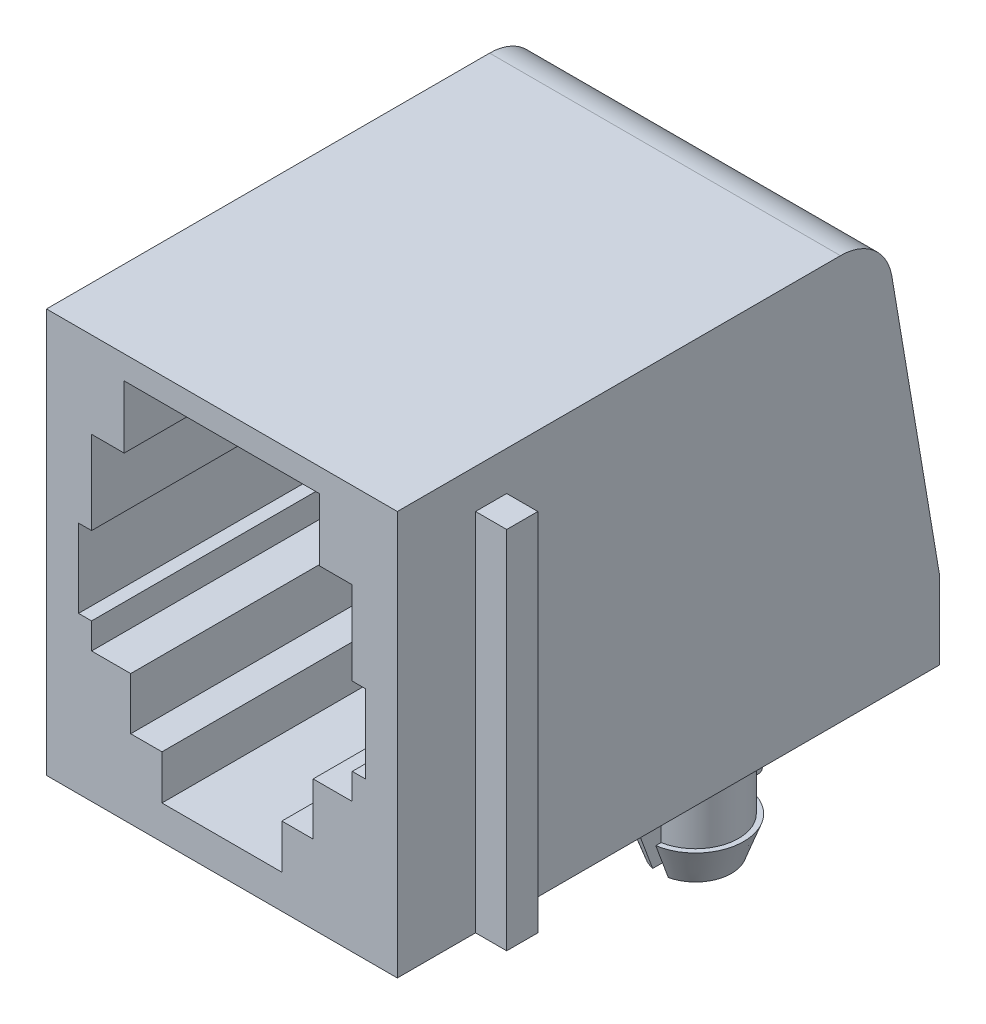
SolidWorks part; units mm, degrees
ref_plane "Front" through (0, 0, 0) normal (0, 0, 1) x (1, 0, 0)
ref_plane "Top" through (0, 0, 0) normal (0, 1, 0) x (1, 0, 0)
ref_plane "Right" through (0, 0, 0) normal (1, 0, 0) x (0, 0, -1)
sketch "Эскиз1" plane through (0, 0, 0) normal (0, 1, 0) x (1, 0, 0)
  circle A0 centre (0, 0) radius 0.4
  dimension "D1" = 0.8
extrude "Вытянуть1" add sketch "Эскиз1" against normal blind 3.3
sketch "Эскиз2" plane through (0, 0, 0) normal (0, 1, 0) x (1, 0, 0)
  line L1 (9.905, -19.53) -> (-3.555, -19.53)
  line L2 (9.905, -19.53) -> (9.905, 1.27)
  line L3 (9.905, 1.27) -> (-3.555, 1.27)
  line L4 (-3.555, -19.53) -> (-3.555, 1.27)
  dimension "D1" = 20.8
  dimension "D2" = 13.46
  dimension "D3" = 3.555
  dimension "D4" = 1.27
extrude "Вытянуть2" add sketch "Эскиз2" along normal blind 15.5
sketch "Эскиз3" plane through (0, 0, 19.53) normal (0, 0, -1) x (-1, 0, 0)
  line L0 (-0.875, 1.3) -> (-5.475, 1.3)
  line L1 (-5.475, 1.3) -> (-5.475, 3)
  line L2 (-5.475, 3) -> (-6.675, 3)
  line L3 (-6.675, 3) -> (-6.675, 5)
  line L4 (-6.675, 5) -> (-8.175, 5)
  line L5 (-8.175, 5) -> (-8.175, 6)
  line L6 (-8.175, 6) -> (-8.675, 6)
  line L7 (-8.675, 6) -> (-8.675, 9)
  line L8 (-8.675, 9) -> (-8.175, 9)
  line L9 (-8.175, 9) -> (-8.175, 12.2)
  line L10 (-8.175, 12.2) -> (-6.925, 12.2)
  line L11 (-3.175, 14.6) -> (-3.175, 1.3) construction
  line L12 (1.825, 9) -> (1.825, 12.2)
  line L13 (2.325, 9) -> (1.825, 9)
  line L14 (2.325, 6) -> (2.325, 9)
  line L15 (1.825, 6) -> (2.325, 6)
  line L16 (1.825, 5) -> (1.825, 6)
  line L17 (0.325, 5) -> (1.825, 5)
  line L18 (0.325, 3) -> (0.325, 5)
  line L19 (-0.875, 3) -> (0.325, 3)
  line L20 (-0.875, 1.3) -> (-0.875, 3)
  line L21 (-9.905, 0) -> (3.555, 0) construction
  line L22 (0.575, 12.2) -> (0.575, 14.6)
  line L23 (0.575, 14.6) -> (-6.925, 14.6)
  line L24 (-6.925, 12.2) -> (-6.925, 14.6)
  line L25 (0.575, 12.2) -> (1.825, 12.2)
  line L26 (3.555, 15.5) -> (-9.905, 15.5) construction
  dimension "D2" = 10
  dimension "D3" = 11
  dimension "D4" = 7
  dimension "D5" = 4.6
  dimension "D6" = 1.3
  dimension "D7" = 3
  dimension "D8" = 5
  dimension "D9" = 6
  dimension "D10" = 3
  dimension "D11" = 12.2
  dimension "D12" = 3.175
  dimension "D13" = 7.5
  dimension "D14" = 0.9
extrude "Вырез-Вытянуть1" cut sketch "Эскиз3" along normal blind 11.3
sketch "Эскиз7" plane through (9.905, 0, 0) normal (1, 0, 0) x (0, 0, -1)
  line L0 (1.27, 3) -> (-0.5579, 13.8328)
  line L1 (1.27, 15.5) -> (1.27, 0) construction
  line L2 (-19.53, 15.5) -> (1.27, 15.5) construction
  line L3 (-2.53, 15.5) -> (1.27, 15.5)
  line L4 (1.27, 15.5) -> (1.27, 3)
  line L5 (-19.53, 15.5) -> (-19.53, 0) construction
  line L6 (-19.53, 0) -> (1.27, 0) construction
  arc A0 (-0.5579, 13.8328) -> (-2.53, 15.5) centre (-2.53, 13.5) ccw
  dimension "D2" = 2
  dimension "D1" = 17
  dimension "D3" = 3
extrude "Вырез-Вытянуть3" cut sketch "Эскиз7" against normal through all
sketch "Эскиз8" plane through (0, 0, -1.27) normal (0, 0, -1) x (-1, 0, 0)
  line L0 (-3.175, 0) -> (-3.175, 13) construction
  line L1 (-8.175, 3) -> (1.825, 3)
  line L2 (-8.175, 3) -> (-8.175, 13)
  line L3 (-8.175, 13) -> (1.825, 13)
  line L4 (1.825, 3) -> (1.825, 13)
  line L5 (-9.905, 0) -> (3.555, 0) construction
  line L6 (3.555, 3) -> (-9.905, 3) construction
  dimension "D1" = 10
extrude "Вырез-Вытянуть4" cut sketch "Эскиз8" against normal blind 5
sketch "Эскиз4" plane through (0, 0, 0) normal (1, 0, 0) x (0, 0, -1)
  line L0 (0, 2) -> (0, 5) construction
  line L1 (-0.0697, 5.8319) -> (-1.3959, 13.6914) construction
  line L2 (-2.53, 14.6502) -> (-16.53, 14.6502) construction
  line L3 (-16.6745, 13.4678) -> (-6.73, 11) construction
  line L4 (0.3, 2) -> (0.3, 5)
  line L5 (0.2261, 5.8818) -> (-1.1, 13.7413)
  line L6 (-2.53, 14.9502) -> (-16.53, 14.9502)
  line L7 (-16.7468, 13.1767) -> (-6.8023, 10.7088)
  line L8 (-0.3, 2) -> (-0.3, 5)
  line L12 (-0.3655, 5.782) -> (-1.6917, 13.6415)
  line L13 (-2.53, 14.3502) -> (-16.53, 14.3502)
  line L14 (-16.6023, 13.759) -> (-6.6577, 11.2912)
  line L15 (1.27, 3) -> (-0.4174, 13) construction
  line L16 (-19.53, 0) -> (1.27, 0) construction
  line L17 (1.27, 3) -> (1.27, 0) construction
  line L18 (-19.53, 15.5) -> (-19.53, 0) construction
  arc A0 (-1.3959, 13.6914) -> (-2.53, 14.6502) centre (-2.53, 13.5) ccw construction
  arc A1 (-16.53, 14.6502) -> (-16.6745, 13.4678) centre (-16.53, 14.0502) ccw construction
  arc A2 (-0.5579, 13.8328) -> (-2.53, 15.5) centre (-2.53, 13.5) ccw construction
  arc A3 (0, 5) -> (-0.0697, 5.8319) centre (-5, 5) ccw construction
  arc A4 (0.3, 5) -> (0.2261, 5.8818) centre (-5, 5) ccw
  arc A5 (-1.1, 13.7413) -> (-2.53, 14.9502) centre (-2.53, 13.5) ccw
  arc A6 (-16.53, 14.9502) -> (-16.7468, 13.1767) centre (-16.53, 14.0502) ccw
  arc A7 (-0.3, 5) -> (-0.3655, 5.782) centre (-5, 5) ccw
  arc A8 (-1.6917, 13.6415) -> (-2.53, 14.3502) centre (-2.53, 13.5) ccw
  arc A9 (-16.53, 14.3502) -> (-16.6023, 13.759) centre (-16.53, 14.0502) ccw
  arc A10 (0.3, 2) -> (-0.3, 2) centre (0, 2) cw
  arc A11 (-6.8023, 10.7088) -> (-6.6577, 11.2912) centre (-6.73, 11) ccw
  dimension "D3" = 0.3
  dimension "D1" = 5
  dimension "D2" = 0.6
  dimension "D4" = 0.3
  dimension "D5" = 2
  dimension "D6" = 5
  dimension "D7" = 11
  dimension "D8" = 8
  dimension "D9" = 3
extrude "Вытянуть3" add sketch "Эскиз4" along normal mid plane 0.6
pattern_linear "Линейный массив1" count 6 spacing 1.27 along (1, 0, 0) count 2 spacing 2.54 along (0, 0, 1) of "Вытянуть1"
pattern_linear "Линейный массив3" count 6 spacing 1.27 along (1, 0, 0) of "Вытянуть3"
ref_plane "Плоскость1" through (-1.815, 0, 0) normal (1, 0, 0) x (0, 0, -1)
sketch "Эскиз5" plane through (-1.815, 0, 0) normal (1, 0, 0) x (0, 0, -1)
  line L0 (-6.35, 0) -> (-6.35, -3.3) construction
  line L1 (1.27, 0) -> (-19.53, 0) construction
  line L2 (-0.4, -3.3) -> (0.4, -3.3) construction
  line L3 (-6.35, -3.3) -> (-4.9732, -3.3)
  line L4 (-4.9732, -3.3) -> (-4.5, -2)
  line L5 (-4.5, -2) -> (-4.7, -2)
  line L6 (-4.7, -2) -> (-4.7, 0)
  line L7 (-4.7, 0) -> (-6.35, 0)
  line L8 (-6.35, 0) -> (-6.35, -3.3)
  dimension "D1" = 6.35
  dimension "D2" = 2
  dimension "D3" = 3.3
  dimension "D4" = 3.7
  dimension "D5" = 20
revolve "Повернуть1" add sketch "Эскиз5" angle 360 about L0
sketch "Эскиз6" plane through (-1.815, 0, 0) normal (1, 0, 0) x (0, 0, -1)
  line L0 (1.27, 0) -> (-19.53, 0) construction
  line L1 (-4.5, 0) -> (-8.2, 0)
  line L2 (-4.5, 0) -> (-4.5, -3.3)
  line L3 (-4.5, -3.3) -> (-8.2, -3.3)
  line L4 (-8.2, 0) -> (-8.2, -3.3)
extrude "Вырез-Вытянуть2" cut sketch "Эскиз6" against normal mid plane 0.6
pattern_linear "Линейный массив4" count 2 spacing 9.98 along (1, 0, 0) of "Повернуть1", "Вырез-Вытянуть2"
sketch "Эскиз9" plane through (0, 0, 0) normal (0, 1, 0) x (1, 0, 0)
  line L0 (-3.555, -2.53) -> (-3.555, -19.53) construction
  line L1 (-3.555, -16.53) -> (-4.75, -16.53)
  line L2 (-3.555, -16.53) -> (-3.555, -15.335)
  line L3 (-3.555, -15.335) -> (-4.75, -15.335)
  line L4 (-4.75, -16.53) -> (-4.75, -15.335)
  line L5 (3.175, 1.27) -> (3.175, -19.53) construction
  line L6 (8.175, 1.27) -> (-1.825, 1.27) construction
  line L7 (-3.555, -19.53) -> (9.905, -19.53) construction
  line L8 (11.1, -16.53) -> (11.1, -15.335)
  line L9 (9.905, -15.335) -> (11.1, -15.335)
  line L10 (9.905, -16.53) -> (9.905, -15.335)
  line L11 (9.905, -16.53) -> (11.1, -16.53)
  dimension "D1" = 15.85
  dimension "D2" = 3
extrude "Вытянуть4" add sketch "Эскиз9" along normal blind 14
other "Удалить грань2" [suppressed]
other "Удалить грань3" [suppressed]
